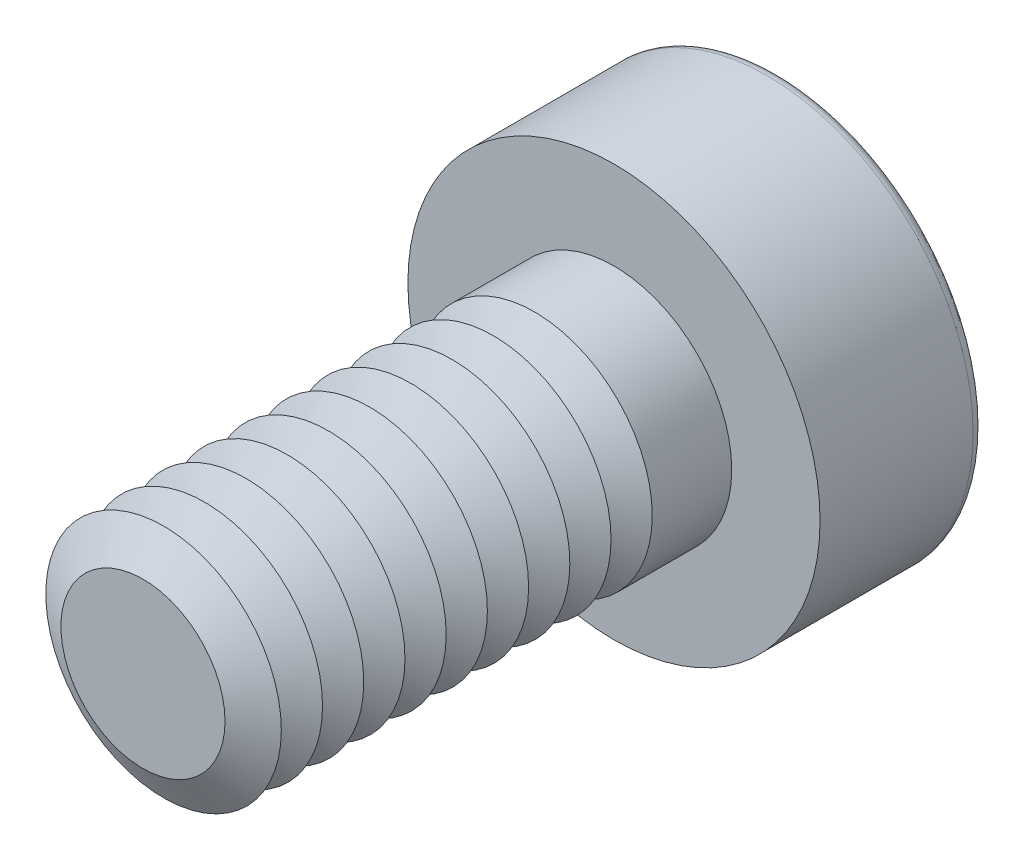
SolidWorks part; units mm, degrees
ref_plane "Front Plane" through (0, 0, 0) normal (0, 0, 1) x (1, 0, 0)
ref_plane "Top Plane" through (0, 0, 0) normal (0, 1, 0) x (1, 0, 0)
ref_plane "Right Plane" through (0, 0, 0) normal (1, 0, 0) x (0, 0, -1)
sketch "Sketch1" plane through (0, 0, 0) normal (0, 0, 1) x (1, 0, 0)
  circle A0 centre (0, 0) radius 2
  dimension "D1" = 4
extrude "Boss-Extrude1" add sketch "Sketch1" along normal blind 8
sketch "Sketch2" plane through (0, 0, 0) normal (0, 0, -1) x (-1, 0, 0)
  circle A0 centre (0, 0) radius 3.5
  dimension "D1" = 7
extrude "Boss-Extrude2" add sketch "Sketch2" along normal blind 2.8
sketch "Sketch3" plane through (0, 0, -2.8) normal (0, 0, -1) x (-1, 0, 0)
  line L1 (-0.7217, 1.25) -> (-1.4434, 0)
  line L2 (-1.4434, 0) -> (-0.7217, -1.25)
  line L3 (-0.7217, -1.25) -> (0.7217, -1.25)
  line L4 (0.7217, -1.25) -> (1.4434, 0)
  line L5 (1.4434, 0) -> (0.7217, 1.25)
  line L6 (0.7217, 1.25) -> (-0.7217, 1.25)
  circle A0 centre (0, 0) radius 1.25 construction
  dimension "D1" = 2.5
extrude "Cut-Extrude1" cut sketch "Sketch3" against normal blind 1.875
fillet "Fillet1" radius 0.2 1 edges at (-3.5, 0, -2.8)
sketch "Sketch4" plane through (0, 0, -0.925) normal (0, 0, -1) x (-1, 0, 0)
  line L0 (0.7217, -1.25) -> (1.4434, 0) construction
  circle A0 centre (0, 0) radius 1.25
extrude "Cut-Extrude2" cut sketch "Sketch4" against normal through all draft 60
sketch "Sketch5" plane through (0, 0, -2.8) normal (0, 0, -1) x (-1, 0, 0)
  circle A0 centre (0, 0) radius 1.4434
extrude "Cut-Extrude3" cut sketch "Sketch5" against normal through all draft 75
sketch "Sketch7" plane through (0, 0, 0) normal (1, 0, 0) x (0, 0, -1)
  line L25 (-8, 1.3938) -> (-7.65, 2)
  line L26 (-8, 2) -> (-8, -2) construction
  line L27 (-7.65, 2) -> (-8.35, 2)
  line L28 (-8.35, 2) -> (-8, 1.3938)
  line L29 (0, 2) -> (-8, 2) construction
  dimension "D1" = 0.7
revolve "Cut-Revolve1" cut sketch "Sketch7" angle 360 about axis through (0, 0, 8) along (0, 0, -1)
pattern_linear "LPattern1" count 10 spacing 0.7 along (0, 0, -1) of "Cut-Revolve1"
